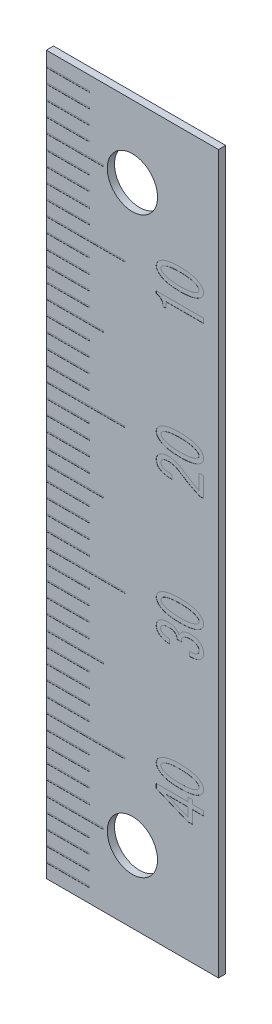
SolidWorks part; units mm, degrees
ref_plane "Front" through (0, 0, 0) normal (0, 0, 1) x (1, 0, 0)
ref_plane "Top" through (0, 0, 0) normal (0, 1, 0) x (1, 0, 0)
ref_plane "Right" through (0, 0, 0) normal (1, 0, 0) x (0, 0, -1)
sketch "Sketch1" plane through (0, 0, 0) normal (0, 0, 1) x (1, 0, 0)
  line L1 (0, 0) -> (0, 50)
  line L2 (0, 0) -> (12, 0)
  line L3 (12, 0) -> (12, 50)
  line L4 (0, 50) -> (12, 50)
  dimension "D1" = 50
  dimension "D2" = 12
extrude "Extrude1" add sketch "Sketch1" along normal blind 0.5
sketch "Sketch2" plane through (0, 0, 0.5) normal (0, 0, 1) x (1, 0, 0)
  line L0 (0, 50) -> (0, 0) construction
  line L1 (0, 0) -> (12, 0) construction
  line L2 (12, 50) -> (0, 50) construction
  circle A0 centre (6, 5) radius 1.75
  circle A1 centre (6, 45) radius 1.75
  dimension "D1" = 6
  dimension "D2" = 6
  dimension "D3" = 5
  dimension "D4" = 5
  dimension "D5" = 3.5
  dimension "D6" = 3.5
extrude "Extrude2" cut sketch "Sketch2" against normal through all
sketch "Sketch3" plane through (0, 0, 0.5) normal (0, 0, 1) x (1, 0, 0)
  line L0 (12, 50) -> (0, 50) construction
  line L1 (7.5, 38.25) -> (11, 38.25) construction
  line L2 (7.5, 38.25) -> (7.5, 41.75) construction
  line L3 (7.5, 41.75) -> (11, 41.75) construction
  line L4 (11, 38.25) -> (11, 41.75) construction
  line L6 (11, 28.25) -> (11, 31.75) construction
  line L7 (11, 18.25) -> (11, 21.75) construction
  line L8 (11, 8.25) -> (11, 11.75) construction
  line L9 (12, 0) -> (12, 50) construction
  text T0 "10" font "ＭＳ ゴシック" height in points 11
  text T1 "20" font "ＭＳ ゴシック" height in points 11
  text T2 "30" font "ＭＳ ゴシック" height in points 11
  text T3 "40" font "ＭＳ ゴシック" height in points 11
  point P4 (11, 40)
  dimension "D1" = 3.5
  dimension "D2" = 10
  dimension "D3" = 1
  dimension "D4" = 3.5
  dimension "D5" = 4
extrude "Extrude3" cut sketch "Sketch3" against normal blind 0.01
sketch "Sketch4" plane through (0, 0, 0.5) normal (0, 0, 1) x (1, 0, 0)
  line L5 (12, 50) -> (0, 50) construction
  line L166 (6, 0) -> (6, 50) construction
  line L167 (0, 0) -> (12, 0) construction
  line L168 (3, 1.05) -> (3, 0.95)
  line L169 (0, 0.95) -> (3, 0.95)
  line L210 (0, 1.05) -> (3, 1.05)
  line L211 (0, 1.05) -> (0, 0.95)
  line L212 (3, 2.05) -> (3, 1.95)
  line L213 (0, 1.95) -> (3, 1.95)
  line L214 (0, 2.05) -> (3, 2.05)
  line L215 (0, 2.05) -> (0, 1.95)
  line L216 (3, 3.05) -> (3, 2.95)
  line L217 (0, 2.95) -> (3, 2.95)
  line L218 (0, 3.05) -> (3, 3.05)
  line L219 (0, 3.05) -> (0, 2.95)
  line L220 (3, 4.05) -> (3, 3.95)
  line L221 (0, 3.95) -> (3, 3.95)
  line L222 (0, 4.05) -> (3, 4.05)
  line L223 (0, 4.05) -> (0, 3.95)
  line L224 (3, 6.05) -> (3, 5.95)
  line L225 (0, 5.95) -> (3, 5.95)
  line L226 (0, 6.05) -> (3, 6.05)
  line L227 (0, 6.05) -> (0, 5.95)
  line L228 (3, 7.05) -> (3, 6.95)
  line L229 (0, 6.95) -> (3, 6.95)
  line L230 (0, 7.05) -> (3, 7.05)
  line L231 (0, 7.05) -> (0, 6.95)
  line L232 (3, 8.05) -> (3, 7.95)
  line L233 (0, 7.95) -> (3, 7.95)
  line L234 (0, 8.05) -> (3, 8.05)
  line L235 (3, 9.05) -> (3, 8.95)
  line L236 (0, 8.95) -> (3, 8.95)
  line L237 (0, 9.05) -> (0, 8.95)
  line L238 (0, 9.05) -> (3, 9.05)
  line L239 (4, 4.95) -> (4, 5.05)
  line L240 (0, 5.05) -> (4, 5.05)
  line L241 (0, 4.95) -> (0, 5.05)
  line L242 (0, 4.95) -> (4, 4.95)
  line L243 (0, 8.05) -> (0, 7.95)
  line L244 (3, 11.05) -> (3, 10.95)
  line L245 (0, 10.95) -> (3, 10.95)
  line L246 (0, 11.05) -> (3, 11.05)
  line L247 (0, 11.05) -> (0, 10.95)
  line L248 (3, 12.05) -> (3, 11.95)
  line L249 (0, 11.95) -> (3, 11.95)
  line L250 (0, 12.05) -> (3, 12.05)
  line L251 (0, 12.05) -> (0, 11.95)
  line L252 (3, 13.05) -> (3, 12.95)
  line L253 (0, 12.95) -> (3, 12.95)
  line L254 (0, 13.05) -> (3, 13.05)
  line L255 (0, 13.05) -> (0, 12.95)
  line L256 (3, 14.05) -> (3, 13.95)
  line L257 (0, 13.95) -> (3, 13.95)
  line L258 (0, 14.05) -> (3, 14.05)
  line L259 (0, 14.05) -> (0, 13.95)
  line L260 (3, 16.05) -> (3, 15.95)
  line L261 (0, 15.95) -> (3, 15.95)
  line L262 (0, 16.05) -> (3, 16.05)
  line L263 (0, 16.05) -> (0, 15.95)
  line L264 (3, 17.05) -> (3, 16.95)
  line L265 (0, 16.95) -> (3, 16.95)
  line L266 (0, 17.05) -> (3, 17.05)
  line L267 (0, 17.05) -> (0, 16.95)
  line L268 (3, 18.05) -> (3, 17.95)
  line L269 (0, 17.95) -> (3, 17.95)
  line L270 (0, 18.05) -> (3, 18.05)
  line L271 (3, 19.05) -> (3, 18.95)
  line L272 (0, 18.95) -> (3, 18.95)
  line L273 (0, 19.05) -> (0, 18.95)
  line L274 (0, 19.05) -> (3, 19.05)
  line L275 (4, 14.95) -> (4, 15.05)
  line L276 (0, 15.05) -> (4, 15.05)
  line L277 (0, 14.95) -> (0, 15.05)
  line L278 (0, 14.95) -> (4, 14.95)
  line L279 (0, 18.05) -> (0, 17.95)
  line L280 (0, 9.95) -> (0, 10.05)
  line L281 (5.5, 9.95) -> (0, 9.95)
  line L282 (5.5, 10.05) -> (5.5, 9.95)
  line L283 (0, 10.05) -> (5.5, 10.05)
  line L284 (3, 21.05) -> (3, 20.95)
  line L285 (0, 20.95) -> (3, 20.95)
  line L286 (0, 21.05) -> (3, 21.05)
  line L287 (0, 21.05) -> (0, 20.95)
  line L288 (3, 22.05) -> (3, 21.95)
  line L289 (0, 21.95) -> (3, 21.95)
  line L290 (0, 22.05) -> (3, 22.05)
  line L291 (0, 22.05) -> (0, 21.95)
  line L292 (3, 23.05) -> (3, 22.95)
  line L293 (0, 22.95) -> (3, 22.95)
  line L294 (0, 23.05) -> (3, 23.05)
  line L295 (0, 23.05) -> (0, 22.95)
  line L296 (3, 24.05) -> (3, 23.95)
  line L297 (0, 23.95) -> (3, 23.95)
  line L298 (0, 24.05) -> (3, 24.05)
  line L299 (0, 24.05) -> (0, 23.95)
  line L300 (3, 26.05) -> (3, 25.95)
  line L301 (0, 25.95) -> (3, 25.95)
  line L302 (0, 26.05) -> (3, 26.05)
  line L303 (0, 26.05) -> (0, 25.95)
  line L304 (3, 27.05) -> (3, 26.95)
  line L305 (0, 26.95) -> (3, 26.95)
  line L306 (0, 27.05) -> (3, 27.05)
  line L307 (0, 27.05) -> (0, 26.95)
  line L308 (3, 28.05) -> (3, 27.95)
  line L309 (0, 27.95) -> (3, 27.95)
  line L310 (0, 28.05) -> (3, 28.05)
  line L311 (3, 29.05) -> (3, 28.95)
  line L312 (0, 28.95) -> (3, 28.95)
  line L313 (0, 29.05) -> (0, 28.95)
  line L314 (0, 29.05) -> (3, 29.05)
  line L315 (4, 24.95) -> (4, 25.05)
  line L316 (0, 25.05) -> (4, 25.05)
  line L317 (0, 24.95) -> (0, 25.05)
  line L318 (0, 24.95) -> (4, 24.95)
  line L319 (0, 28.05) -> (0, 27.95)
  line L320 (0, 19.95) -> (0, 20.05)
  line L321 (5.5, 19.95) -> (0, 19.95)
  line L322 (5.5, 20.05) -> (5.5, 19.95)
  line L323 (0, 20.05) -> (5.5, 20.05)
  line L324 (3, 31.05) -> (3, 30.95)
  line L325 (0, 30.95) -> (3, 30.95)
  line L326 (0, 31.05) -> (3, 31.05)
  line L327 (0, 31.05) -> (0, 30.95)
  line L328 (3, 32.05) -> (3, 31.95)
  line L329 (0, 31.95) -> (3, 31.95)
  line L330 (0, 32.05) -> (3, 32.05)
  line L331 (0, 32.05) -> (0, 31.95)
  line L332 (3, 33.05) -> (3, 32.95)
  line L333 (0, 32.95) -> (3, 32.95)
  line L334 (0, 33.05) -> (3, 33.05)
  line L335 (0, 33.05) -> (0, 32.95)
  line L336 (3, 34.05) -> (3, 33.95)
  line L337 (0, 33.95) -> (3, 33.95)
  line L338 (0, 34.05) -> (3, 34.05)
  line L339 (0, 34.05) -> (0, 33.95)
  line L340 (3, 36.05) -> (3, 35.95)
  line L341 (0, 35.95) -> (3, 35.95)
  line L342 (0, 36.05) -> (3, 36.05)
  line L343 (0, 36.05) -> (0, 35.95)
  line L344 (3, 37.05) -> (3, 36.95)
  line L345 (0, 36.95) -> (3, 36.95)
  line L346 (0, 37.05) -> (3, 37.05)
  line L347 (0, 37.05) -> (0, 36.95)
  line L348 (3, 38.05) -> (3, 37.95)
  line L349 (0, 37.95) -> (3, 37.95)
  line L350 (0, 38.05) -> (3, 38.05)
  line L351 (3, 39.05) -> (3, 38.95)
  line L352 (0, 38.95) -> (3, 38.95)
  line L353 (0, 39.05) -> (0, 38.95)
  line L354 (0, 39.05) -> (3, 39.05)
  line L355 (4, 34.95) -> (4, 35.05)
  line L356 (0, 35.05) -> (4, 35.05)
  line L357 (0, 34.95) -> (0, 35.05)
  line L358 (0, 34.95) -> (4, 34.95)
  line L359 (0, 38.05) -> (0, 37.95)
  line L360 (3, 41.05) -> (3, 40.95)
  line L361 (0, 40.95) -> (3, 40.95)
  line L362 (0, 41.05) -> (3, 41.05)
  line L363 (0, 41.05) -> (0, 40.95)
  line L364 (3, 42.05) -> (3, 41.95)
  line L365 (0, 41.95) -> (3, 41.95)
  line L366 (0, 42.05) -> (3, 42.05)
  line L367 (0, 42.05) -> (0, 41.95)
  line L368 (3, 43.05) -> (3, 42.95)
  line L369 (0, 42.95) -> (3, 42.95)
  line L370 (0, 43.05) -> (3, 43.05)
  line L371 (0, 43.05) -> (0, 42.95)
  line L372 (3, 44.05) -> (3, 43.95)
  line L373 (0, 43.95) -> (3, 43.95)
  line L374 (0, 44.05) -> (3, 44.05)
  line L375 (0, 44.05) -> (0, 43.95)
  line L376 (0, 29.95) -> (0, 30.05)
  line L377 (5.5, 29.95) -> (0, 29.95)
  line L378 (5.5, 30.05) -> (5.5, 29.95)
  line L379 (0, 30.05) -> (5.5, 30.05)
  line L380 (3, 46.05) -> (3, 45.95)
  line L381 (0, 45.95) -> (3, 45.95)
  line L382 (0, 46.05) -> (3, 46.05)
  line L383 (0, 46.05) -> (0, 45.95)
  line L384 (3, 47.05) -> (3, 46.95)
  line L385 (0, 46.95) -> (3, 46.95)
  line L386 (0, 47.05) -> (3, 47.05)
  line L387 (0, 47.05) -> (0, 46.95)
  line L388 (3, 48.05) -> (3, 47.95)
  line L389 (0, 47.95) -> (3, 47.95)
  line L390 (0, 48.05) -> (3, 48.05)
  line L391 (3, 49.05) -> (3, 48.95)
  line L392 (0, 48.95) -> (3, 48.95)
  line L393 (0, 49.05) -> (0, 48.95)
  line L394 (0, 49.05) -> (3, 49.05)
  line L395 (4, 44.95) -> (4, 45.05)
  line L396 (0, 45.05) -> (4, 45.05)
  line L397 (0, 44.95) -> (0, 45.05)
  line L398 (0, 44.95) -> (4, 44.95)
  line L399 (0, 48.05) -> (0, 47.95)
  line L400 (0, 39.95) -> (0, 40.05)
  line L401 (5.5, 39.95) -> (0, 39.95)
  line L402 (5.5, 40.05) -> (5.5, 39.95)
  line L403 (0, 40.05) -> (5.5, 40.05)
extrude "Extrude4" cut sketch "Sketch4" against normal blind 0.01
move or copy body "Body-Move/Copy2" bodies to move or copy 105 copy no translate (0, -50, 0)
